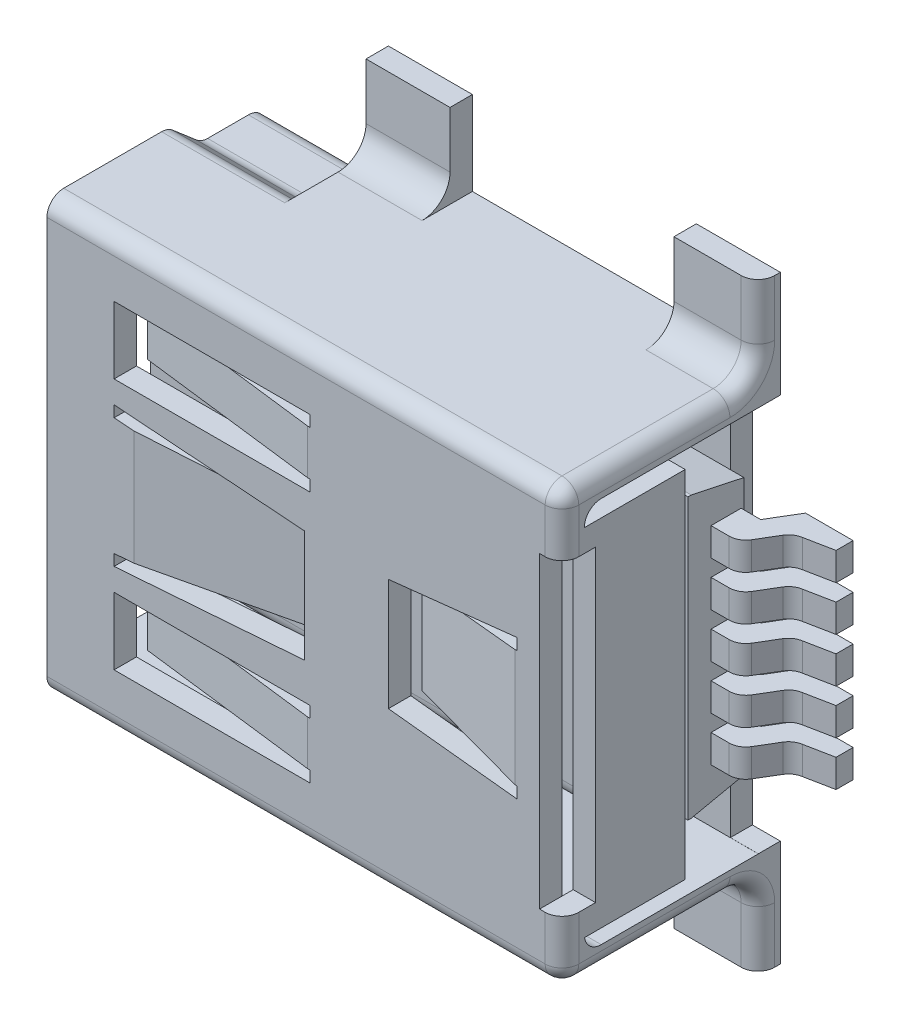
SolidWorks part; units mm, degrees
ref_plane "Front Plane" through (0, 0, 0) normal (0, 0, 1) x (1, 0, 0)
ref_plane "Top Plane" through (0, 0, 0) normal (0, 1, 0) x (1, 0, 0)
ref_plane "Right Plane" through (0, 0, 0) normal (1, 0, 0) x (0, 0, -1)
sketch "Sketch1" plane through (0, 0, 0) normal (0, 0, 1) x (1, 0, 0)
  line L1 (-4.6, 3.85) -> (4.6, 3.85)
  line L2 (-4.6, 3.85) -> (-4.6, -3.85)
  line L3 (-4.6, -3.85) -> (4.6, -3.85)
  line L4 (4.6, 3.85) -> (4.6, -3.85)
  line L5 (-4.6, 3.85) -> (4.6, -3.85) construction
  line L6 (-4.6, -3.85) -> (4.6, 3.85) construction
  point P0 (0, 0)
  dimension "D1" = 9.2
  dimension "D2" = 7.7
extrude "Boss-Extrude1" add sketch "Sketch1" along normal blind 3.9
sketch "Sketch2" plane through (-4.6, 0, 0) normal (-1, 0, 0) x (0, 0, 1)
  line L0 (3.5, 3.45) -> (3.5, -3.45)
  line L1 (3.5, -3.45) -> (2, -3.45)
  line L2 (2, -3.45) -> (1.4, -2.935)
  line L3 (1.4, -2.935) -> (0.4, -2.935)
  line L4 (0.4, -2.935) -> (0.4, 2.935)
  line L5 (0.4, 2.935) -> (1.4, 2.935)
  line L6 (1.4, 2.935) -> (2, 3.45)
  line L7 (2, 3.45) -> (3.5, 3.45)
  line L8 (0, 3.85) -> (0, -3.85) construction
  line L10 (3.9, 3.85) -> (0, 3.85) construction
  line L13 (3.9, -3.85) -> (0, -3.85) construction
  dimension "D1" = 6.9
  dimension "D2" = 5.87
  dimension "D3" = 3.1
  dimension "D4" = 0.4
  dimension "D5" = 0.915
  dimension "D6" = 1.5
  dimension "D7" = 1.5
  dimension "D8" = 1
  dimension "D9" = 1
  dimension "D10" = 0.4
extrude "Cut-Extrude1" cut sketch "Sketch2" against normal blind 9.2
sketch "Sketch3" plane through (-4.6, 0, 0) normal (-1, 0, 0) x (0, 0, 1)
  line L0 (0, 3.335) -> (1.1402, 3.335)
  line L1 (0, 3.85) -> (0, -3.85) construction
  line L2 (1.1402, 3.335) -> (1.7402, 3.85)
  line L3 (3.9, 3.85) -> (0, 3.85) construction
  line L4 (1.7402, 3.85) -> (0, 3.85)
  line L5 (0, 3.85) -> (0, 3.335)
  line L6 (0, -3.335) -> (1.1402, -3.335)
  line L7 (1.1402, -3.335) -> (1.7402, -3.85)
  line L8 (3.9, -3.85) -> (0, -3.85) construction
  line L9 (1.7402, -3.85) -> (0, -3.85)
  line L10 (0, -3.85) -> (0, -3.335)
  line L11 (1.4, 2.935) -> (0.4, 2.935) construction
  line L12 (0.4, -2.935) -> (1.4, -2.935) construction
  line L13 (2, 3.45) -> (1.4, 2.935) construction
  line L14 (1.4, -2.935) -> (2, -3.45) construction
  dimension "D1" = 0.4
  dimension "D2" = 0.4
extrude "Cut-Extrude2" cut sketch "Sketch3" against normal blind 2.2
sketch "Sketch4" plane through (-2.4, 0, 0) normal (-1, 0, 0) x (0, 0, 1)
  line L0 (0.4, 3.335) -> (0.4, 3.45)
  line L1 (0, 3.335) -> (1.1402, 3.335) construction
  line L2 (0.4, 3.45) -> (1.2741, 3.45)
  line L3 (1.1402, 3.335) -> (1.7402, 3.85) construction
  line L4 (1.2741, 3.45) -> (1.1402, 3.335)
  line L5 (1.1402, 3.335) -> (0.4, 3.335)
  line L6 (0.4, -3.335) -> (0.4, -3.45)
  line L7 (1.1402, -3.335) -> (0, -3.335) construction
  line L8 (0.4, -3.45) -> (1.2741, -3.45)
  line L9 (1.7402, -3.85) -> (1.1402, -3.335) construction
  line L10 (1.2741, -3.45) -> (1.1402, -3.335)
  line L11 (1.1402, -3.335) -> (0.4, -3.335)
  line L12 (0, -3.335) -> (0, -3.85) construction
  line L13 (0, -3.85) -> (1.7402, -3.85) construction
  line L14 (0, 3.85) -> (0, 3.335) construction
  line L15 (1.7402, 3.85) -> (0, 3.85) construction
  dimension "D1" = 0.4
  dimension "D2" = 0.4
  dimension "D3" = 0.4
  dimension "D4" = 0.4
extrude "Cut-Extrude3" cut sketch "Sketch4" against normal blind 2.2
sketch "Sketch5" plane through (4.6, 0, 0) normal (1, 0, 0) x (0, 0, -1)
  line L1 (-3.5, 3.45) -> (-0.3926, 3.45)
  line L2 (-3.5, 3.45) -> (-3.5, -3.45)
  line L3 (-3.5, -3.45) -> (-0.3926, -3.45)
  line L4 (-0.3926, 3.45) -> (-0.3926, -3.45)
extrude "Cut-Extrude4" cut sketch "Sketch5" against normal blind 7
sketch "Sketch6" plane through (0, 0, 0) normal (0, 0, -1) x (-1, 0, 0)
  line L0 (-4.6, 3.85) -> (2.4, 3.85) construction
  line L1 (-4.6, 3.85) -> (-3.1, 3.85)
  line L2 (-4.6, 3.85) -> (-4.6, 5.35)
  line L3 (-4.6, 5.35) -> (-3.1, 5.35)
  line L4 (-3.1, 3.85) -> (-3.1, 5.35)
  line L5 (0.9, 3.85) -> (2.4, 3.85)
  line L6 (0.9, 3.85) -> (0.9, 5.35)
  line L7 (0.9, 5.35) -> (2.4, 5.35)
  line L8 (2.4, 3.85) -> (2.4, 5.35)
  line L9 (2.4, -3.85) -> (-4.6, -3.85) construction
  line L10 (-4.6, -3.85) -> (-3.1, -3.85)
  line L11 (-4.6, -3.85) -> (-4.6, -5.35)
  line L12 (-4.6, -5.35) -> (-3.1, -5.35)
  line L13 (-3.1, -3.85) -> (-3.1, -5.35)
  line L14 (0.9, -3.85) -> (2.4, -3.85)
  line L15 (0.9, -3.85) -> (0.9, -5.35)
  line L16 (0.9, -5.35) -> (2.4, -5.35)
  line L17 (2.4, -3.85) -> (2.4, -5.35)
  dimension "D1" = 1.5
  dimension "D2" = 1.5
  dimension "D3" = 1.5
  dimension "D4" = 1.5
  dimension "D5" = 1.5
  dimension "D6" = 1.5
  dimension "D7" = 1.5
  dimension "D8" = 1.5
  dimension "D9" = 4
  dimension "D10" = 4
extrude "Boss-Extrude2" add sketch "Sketch6" against normal blind 0.4
sketch "Sketch7" plane through (0, 0, 3.9) normal (0, 0, 1) x (1, 0, 0)
  line L0 (-4.6, 3.85) -> (-4.6, -3.85) construction
  line L1 (-3.4, 2.85) -> (0.1, 2.85)
  line L2 (-3.4, 2.85) -> (-3.4, 1.65)
  line L3 (-3.4, 1.65) -> (0.1, 1.65)
  line L4 (0.1, 2.85) -> (0.1, 2.65)
  line L5 (-3.4, -2.85) -> (0.1, -2.85)
  line L6 (-3.4, -2.85) -> (-3.4, -1.65)
  line L7 (-3.4, -1.65) -> (0.1, -1.65)
  line L8 (0.1, -2.85) -> (0.1, -2.65)
  line L9 (4.6, 3.85) -> (-4.6, 3.85) construction
  line L10 (-4.6, -3.85) -> (4.6, -3.85) construction
  line L11 (0.1, 2.65) -> (-3.2, 2.65)
  line L12 (-3.2, 2.65) -> (-3.2, 1.85)
  line L13 (-3.2, 1.85) -> (0.1, 1.85)
  line L14 (0.1, -1.85) -> (-3.2, -1.85)
  line L15 (-3.2, -1.85) -> (-3.2, -2.65)
  line L16 (-3.2, -2.65) -> (0.1, -2.65)
  line L17 (0.1, -1.85) -> (0.1, -1.65)
  line L18 (0.1, 1.85) -> (0.1, 1.65)
  line L19 (-3.4, 1.25) -> (-3.4, 1.0495)
  line L20 (-3.4, -1.25) -> (0, -1)
  line L21 (0, -1) -> (0, 1)
  line L22 (0, 1) -> (-3.4, 1.25)
  line L23 (-3.4, 1.0495) -> (-0.2, 0.8142)
  line L24 (-0.2, 0.8142) -> (-0.2, -0.8142)
  line L25 (-0.2, -0.8142) -> (-3.4, -1.0495)
  line L26 (-3.4, -1.0495) -> (-3.4, -1.25)
  line L27 (3.8, 1.25) -> (1.5, 1)
  line L28 (1.5, 1) -> (1.5, -1)
  line L29 (1.5, -1) -> (3.8, -1.25)
  line L30 (3.8, -1.25) -> (3.8, -1.0488)
  line L31 (4.6, -3.85) -> (4.6, 3.85) construction
  line L32 (3.8, 1.0488) -> (1.7, 0.8206)
  line L33 (1.7, 0.8206) -> (1.7, -0.8206)
  line L34 (1.7, -0.8206) -> (3.8, -1.0488)
  line L35 (3.8, 1.0488) -> (3.8, 1.25)
  dimension "D1" = 1.2
  dimension "D2" = 1.2
  dimension "D3" = 3.5
  dimension "D4" = 3.5
  dimension "D5" = 1
  dimension "D6" = 1
  dimension "D7" = 1.2
  dimension "D8" = 1.2
  dimension "D9" = 0.2
  dimension "D10" = 0.2
  dimension "D11" = 0.2
  dimension "D12" = 0.2
  dimension "D13" = 0.2
  dimension "D14" = 0.2
  dimension "D15" = 2.5
  dimension "D16" = 2
  dimension "D17" = 1.25
  dimension "D18" = 0
  dimension "D19" = 1
  dimension "D20" = 0.2
  dimension "D21" = 0.2
  dimension "D22" = 0.2
  dimension "D23" = 2.5
  dimension "D24" = 2
  dimension "D25" = 1
  dimension "D26" = 1.25
  dimension "D27" = 2.3
  dimension "D28" = 0.8
  dimension "D29" = 0.2
  dimension "D30" = 0.2
  dimension "D31" = 0.2
extrude "Cut-Extrude5" cut sketch "Sketch7" against normal blind 0.4
sketch "Sketch8" plane through (0, 0, 3.9) normal (0, 0, 1) x (1, 0, 0)
  line L0 (0.1, 2.65) -> (0.1, 1.85)
  line L1 (0.1, 1.85) -> (-3.2, 1.85) construction
  line L2 (0.1, 1.85) -> (-3.2, 1.85)
  line L3 (-3.2, 1.85) -> (-3.2, 2.65)
  line L4 (-3.2, 2.65) -> (0.1, 2.65)
  line L5 (-3.4, 1.0495) -> (-3.4, -1.0495)
  line L6 (-3.4, -1.0495) -> (-0.2, -0.8142)
  line L7 (-0.2, -0.8142) -> (-0.2, 0.8142)
  line L8 (-0.2, 0.8142) -> (-3.4, 1.0495)
  line L9 (0.1, -1.85) -> (0.1, -2.65)
  line L10 (0.1, -2.65) -> (-3.2, -2.65)
  line L11 (-3.2, -2.65) -> (-3.2, -1.85)
  line L12 (-3.2, -1.85) -> (0.1, -1.85)
  line L13 (3.8, 1.0488) -> (3.8, -1.0488)
  line L14 (3.8, -1.0488) -> (1.7, -0.8206)
  line L15 (1.7, -0.8206) -> (1.7, 0.8206)
  line L16 (1.7, 0.8206) -> (3.8, 1.0488)
extrude "Boss-Extrude3" add sketch "Sketch8" against normal blind 0.8
chamfer "Chamfer2" distance 0.4 angle 83 2 edges at (-3.2, -2.25, 3.9) (-3.2, 2.25, 3.9)
chamfer "Chamfer3" distance 0.4 angle 83 2 edges at (0.1, -2.25, 3.1) (0.1, 2.25, 3.1)
chamfer "Chamfer4" distance 0.4 angle 82 1 edges at (-0.2, 0, 3.9)
chamfer "Chamfer5" distance 0.4 angle 82 1 edges at (-3.4, 0, 3.1)
chamfer "Chamfer6" distance 0.4 angle 79 1 edges at (1.7, 0, 3.9)
chamfer "Chamfer7" distance 0.4 angle 79 1 edges at (3.8, 0, 3.1)
chamfer "Chamfer8" distance 0.4 angle 45 3 edges at (1.7, 0, 3.1) (-3.2, 2.25, 3.1) (-3.2, -2.25, 3.1)
chamfer "Chamfer9" distance 0.4 angle 45 1 edges at (-0.2, 0, 3.1)
fillet "Fillet1" radius 0.5 4 edges at (-1.65, -3.85, 0.4) (-1.65, 3.85, 0.4)
fillet "Fillet2" radius 0.3 16 edges at (-3.5, -3.45, 2) (-3.5, -2.935, 1.4) (-3.5, -2.935, 0.4) (0, -3.45, 3.5) (0, 3.45, 3.5) (-3.5, 2.935, 1.4) (-3.5, 3.45, 2) (-3.5, 2.935, 0.4) (-3.5, -3.335, 0) (-3.5, -3.335, 1.1402) (-3.5, -3.85, 1.7402) (0, -3.85, 3.9) (0, 3.85, 3.9) (-3.5, 3.85, 1.7402) (-3.5, 3.335, 0) (-3.5, 3.335, 1.1402)
sketch "Sketch9" plane through (4.6, 0, 0) normal (1, 0, 0) x (0, 0, -1)
  line L0 (-1.4843, -3.0074) -> (-1.9157, -3.3776) construction
  line L1 (-3.5, 3.15) -> (-1.7, 3.15)
  line L2 (-3.5, 3.15) -> (-3.5, -3.1925)
  line L3 (-3.5, -3.1925) -> (-1.7, -3.1925)
  line L4 (-1.7, 3.15) -> (-1.7, -3.1925)
extrude "Boss-Extrude5" add sketch "Sketch9" against normal blind 0.4
sketch "Sketch10" plane through (4.6, 0, 0) normal (1, 0, 0) x (0, 0, -1)
  line L0 (-3.9, -3.55) -> (-3.9, 3.55) construction
  line L1 (-3.9, 2.75) -> (-3.3, 2.75)
  line L2 (-3.9, 2.75) -> (-3.9, -2.75)
  line L3 (-3.9, -2.75) -> (-3.3, -2.75)
  line L4 (-3.3, 2.75) -> (-3.3, -2.75)
  dimension "D1" = 0.6
  dimension "D2" = 5.5
  dimension "D3" = 2.75
extrude "Cut-Extrude6" cut sketch "Sketch10" against normal blind 0.4
fillet "Fillet3" radius 0.3 10 edges at (4.6, 3.9964, 0.5464) (4.6, 3.7621, 3.8121) (4.6, -3.9964, 0.5464) (4.6, -3.7621, 3.8121) (4.6, 3.15, 3.9) (4.6, -3.15, 3.9)
sketch "Sketch11" plane through (-4.6, 0, 0) normal (-1, 0, 0) x (0, 0, 1)
  line L0 (0.4, 2.635) -> (0.4, -2.635) construction
  line L1 (0.45, 2.5) -> (2.25, 2.5)
  line L2 (0.45, 2.5) -> (0.45, -2.5)
  line L3 (0.45, -2.5) -> (2.25, -2.5)
  line L4 (2.25, 2.5) -> (2.25, -2.5)
  dimension "D1" = 0.05
  dimension "D2" = 1.8
  dimension "D3" = 5
  dimension "D4" = 2.5
extrude "Boss-Extrude6" add sketch "Sketch11" against normal blind 8.8
sketch "Sketch12" plane through (-4.6, 0, 0) normal (-1, 0, 0) x (0, 0, 1)
  line L0 (1.5999, 1.1151) -> (1.9999, 1.1151)
  line L1 (1.5999, 0.2151) -> (1.9999, 0.2151)
  line L2 (1.5999, 0.2151) -> (1.5999, -0.1849)
  line L3 (1.5999, -0.1849) -> (1.9999, -0.1849)
  line L4 (1.9999, 0.2151) -> (1.9999, -0.1849)
  line L5 (1.5999, 0.2151) -> (1.9999, -0.1849) construction
  line L6 (1.5999, -0.1849) -> (1.9999, 0.2151) construction
  line L7 (1.5999, 0.7151) -> (1.9999, 0.7151)
  line L8 (1.9999, 1.1151) -> (1.9999, 0.7151)
  line L9 (1.5999, 1.1151) -> (1.5999, 0.7151)
  line L10 (1.5999, 2.0151) -> (1.9999, 2.0151)
  line L11 (1.5999, 1.6151) -> (1.9999, 1.6151)
  line L12 (1.9999, 2.0151) -> (1.9999, 1.6151)
  line L13 (1.5999, 2.0151) -> (1.5999, 1.6151)
  line L14 (1.5999, 0.2151) -> (1.9999, 0.2151)
  line L15 (1.5999, -0.1849) -> (1.9999, -0.1849)
  line L16 (1.9999, 0.2151) -> (1.9999, -0.1849)
  line L17 (1.5999, 0.2151) -> (1.5999, -0.1849)
  line L18 (1.5999, 1.1151) -> (1.9999, 1.1151)
  line L19 (1.5999, 0.7151) -> (1.9999, 0.7151)
  line L20 (1.9999, 1.1151) -> (1.9999, 0.7151)
  line L21 (1.5999, 1.1151) -> (1.5999, 0.7151)
  line L22 (1.5999, -0.6849) -> (1.9999, -0.6849)
  line L23 (1.5999, -1.0849) -> (1.9999, -1.0849)
  line L24 (1.9999, -0.6849) -> (1.9999, -1.0849)
  line L25 (1.5999, -0.6849) -> (1.5999, -1.0849)
  line L26 (1.5999, 0.2151) -> (1.9999, 0.2151)
  line L27 (1.5999, -0.1849) -> (1.9999, -0.1849)
  line L28 (1.9999, 0.2151) -> (1.9999, -0.1849)
  line L29 (1.5999, 0.2151) -> (1.5999, -0.1849)
  line L30 (1.5999, -0.6849) -> (1.9999, -0.6849)
  line L31 (1.5999, -1.0849) -> (1.9999, -1.0849)
  line L32 (1.9999, -0.6849) -> (1.9999, -1.0849)
  line L33 (1.5999, -0.6849) -> (1.5999, -1.0849)
  line L34 (1.5999, -1.5849) -> (1.9999, -1.5849)
  line L35 (1.5999, -1.9849) -> (1.9999, -1.9849)
  line L36 (1.9999, -1.5849) -> (1.9999, -1.9849)
  line L37 (1.5999, -1.5849) -> (1.5999, -1.9849)
  point P0 (1.7999, 0.0151)
  dimension "D1" = 0.4
  dimension "D2" = 0.4
  dimension "D3" = 1.8
  dimension "D4" = 3
  dimension "D5" = 3
extrude "Cut-Extrude7" cut sketch "Sketch12" against normal blind 5 contours L4 L1 L2 L3 | L0 L9 L7 L8 | L10 L13 L11 L12 | L22 L25 L23 L24 | L34 L37 L35 L36
sketch "Sketch13" plane through (-4.6, 0, 0) normal (-1, 0, 0) x (0, 0, 1)
  line L1 (0.45, 2.5) -> (2.25, 2.5)
  line L2 (0.45, 2.5) -> (0.45, -2.5)
  line L3 (0.45, -2.5) -> (2.25, -2.5)
  line L4 (2.25, 2.5) -> (2.25, -2.5)
extrude "Cut-Extrude8" cut sketch "Sketch13" against normal blind 0.2
fillet "Fillet4" radius 0.3 2 edges at (-0.1, -2.5, 2.25) (-0.1, 2.5, 2.25)
sketch "Sketch14" plane through (4.2, 0, 0) normal (1, 0, 0) x (0, 0, -1)
  line L0 (-0.45, -2.5) -> (-1.7, -2.5) construction
  line L1 (-0.45, 2.5) -> (-1.45, 2.5)
  line L2 (-0.45, 2.5) -> (-0.45, -2.5)
  line L3 (-0.45, -2.5) -> (-1.45, -2.5)
  line L4 (-1.45, 2.5) -> (-1.45, -2.5)
  dimension "D1" = 1
extrude "Boss-Extrude7" add sketch "Sketch14" along normal blind 0.2
sketch "Sketch15" plane through (4.6, 0, 0) normal (1, 0, 0) x (0, 0, -1)
  line L0 (0, -5.35) -> (0, 5.35) construction
  line L1 (-0.3926, 3.45) -> (0, 3.45)
  line L2 (-0.3926, 3.45) -> (-0.3926, -3.4485)
  line L3 (-0.3926, -3.4485) -> (0, -3.4485)
  line L4 (0, 3.45) -> (0, -3.4485)
extrude "Cut-Extrude9" cut sketch "Sketch15" against normal blind 0.5
sketch "Sketch16" plane through (4.4, 0, 0) normal (1, 0, 0) x (0, 0, -1)
  line L0 (0, -3.4485) -> (0, 3.45) construction
  line L1 (-1.3, 1.85) -> (0, 1.85)
  line L2 (-1.3, 1.85) -> (-1.3, 1.35)
  line L3 (-1.3, 1.35) -> (0, 1.35)
  line L4 (0, 1.85) -> (0, 1.35)
  line L5 (-1.3, 1.05) -> (0, 1.05)
  line L6 (-1.3, 1.05) -> (-1.3, 0.55)
  line L7 (-1.3, 0.55) -> (0, 0.55)
  line L8 (0, 1.05) -> (0, 0.55)
  line L9 (-1.3, 0.25) -> (0, 0.25)
  line L10 (-1.3, 0.25) -> (-1.3, -0.25)
  line L11 (-1.3, -0.25) -> (0, -0.25)
  line L12 (0, 0.25) -> (0, -0.25)
  line L13 (-1.3, -0.55) -> (0, -0.55)
  line L14 (-1.3, -0.55) -> (-1.3, -1.05)
  line L15 (-1.3, -1.05) -> (0, -1.05)
  line L16 (0, -0.55) -> (0, -1.05)
  line L17 (-1.3, -1.35) -> (0, -1.35)
  line L18 (-1.3, -1.35) -> (-1.3, -1.85)
  line L19 (-1.3, -1.85) -> (0, -1.85)
  line L20 (0, -1.35) -> (0, -1.85)
  line L21 (-0.45, 2.5) -> (-1.45, 2.5) construction
  dimension "D1" = 1.3
  dimension "D2" = 0.5
  dimension "D4" = 0.65
  dimension "D3" = 5
extrude "Boss-Extrude8" add sketch "Sketch16" along normal blind 1.5
sketch "Sketch17" plane through (0, -1.85, 0) normal (0, -1, 0) x (1, 0, 0)
  line L0 (5.9, 0.4) -> (5.2765, 0.4)
  line L1 (5.9, 1.3) -> (5.9, 0) construction
  line L2 (5.2765, 0.4) -> (4.8936, 1.0381)
  line L3 (5.9, 1.3) -> (4.4, 1.3) construction
  line L4 (4.8608, 1.3) -> (5.9, 1.3)
  line L5 (5.9, 1.3) -> (5.9, 0.4)
  line L6 (5.05, 0) -> (4.75, 0.5)
  line L7 (5.9, 0) -> (4.4, 0) construction
  line L8 (4.75, 0.5) -> (4.4, 0.5)
  line L9 (4.4, 1.3) -> (4.4, 0.45) construction
  line L10 (4.4, 0.5) -> (4.4, 0)
  line L11 (4.4, 0) -> (5.05, 0)
  line L12 (4.8936, 1.0381) -> (4.4, 1.0381)
  line L13 (4.4, 1.0381) -> (4.4, 1.3)
  line L14 (4.4, 1.3) -> (4.8608, 1.3)
  dimension "D1" = 0.4
  dimension "D2" = 0.4
  dimension "D3" = 0.35
  dimension "D4" = 0.3
  dimension "D5" = 0.5
extrude "Cut-Extrude10" cut sketch "Sketch17" against normal blind 4
fillet "Fillet5" radius 0.3 10 edges at (4.8936, -1.6, 1.0381) (4.8936, -0.8, 1.0381) (4.8936, 0, 1.0381) (4.8936, 0.8, 1.0381) (4.8936, 1.6, 1.0381) (5.2765, 1.6, 0.4) (5.2765, 0.8, 0.4) (5.2765, 0, 0.4) (5.2765, -0.8, 0.4) (5.2765, -1.6, 0.4)
chamfer "Chamfer10" distance 0.1 angle 79 5 edges at (5.9, 1.6, 0.4) (5.9, 0.8, 0.4) (5.9, 0, 0.4) (5.9, -0.8, 0.4) (5.9, -1.6, 0.4)
chamfer "Chamfer11" distance 0.2 angle 78 2 edges at (0, -2.5, 0.45) (0, 2.5, 0.45)
sketch "Sketch18" plane through (-4.4, 0, 0) normal (-1, 0, 0) x (0, 0, 1)
  line L0 (0.45, 1.75) -> (0.45, -1.75)
  line L1 (0.45, 2.3) -> (0.45, -2.3) construction
  line L2 (0.45, -1.75) -> (0.95, -1.5)
  line L3 (0.95, -1.5) -> (0.95, 1.5)
  line L4 (0.95, 1.5) -> (0.45, 1.75)
  line L5 (0, 3.035) -> (0, -3.035) construction
  point P4 (0, 0)
  point P9 (0, 0)
  dimension "D1" = 3
  dimension "D2" = 1.5
  dimension "D3" = 3.5
  dimension "D4" = 1.75
  dimension "D5" = 0.5
extrude "Cut-Extrude11" cut sketch "Sketch18" against normal blind 6 contours L3 L4 L0 L2
chamfer "Chamfer13" distance 0.2 angle 78 1 edges at (-4.4, 2.025, 0.45)
